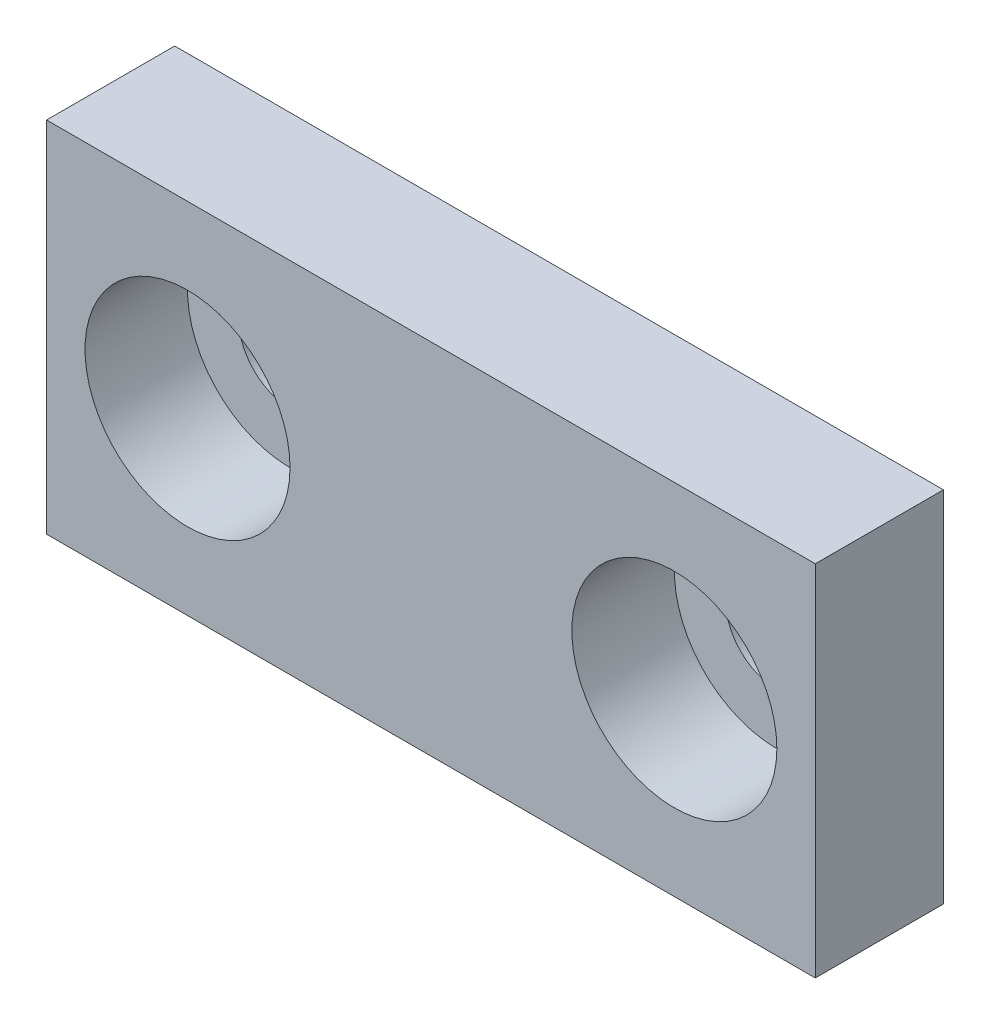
SolidWorks part; units mm, degrees
ref_plane "Front Plane" through (0, 0, 0) normal (0, 0, 1) x (1, 0, 0)
ref_plane "Top Plane" through (0, 0, 0) normal (0, 1, 0) x (1, 0, 0)
ref_plane "Right Plane" through (0, 0, 0) normal (1, 0, 0) x (0, 0, -1)
sketch "Sketch1" plane through (0, 0, 0) normal (0, 0, 1) x (1, 0, 0)
  line L1 (-15, 7) -> (15, 7)
  line L2 (-15, 7) -> (-15, -7)
  line L3 (-15, -7) -> (15, -7)
  line L4 (15, 7) -> (15, -7)
  line L5 (-15, 7) -> (15, -7) construction
  line L6 (-15, -7) -> (15, 7) construction
  point P1 (0, 0)
  dimension "D1" = 30
  dimension "D2" = 14
extrude "Boss-Extrude1" add sketch "Sketch1" along normal blind 5
sketch "Sketch2" plane through (0, 0, 5) normal (0, 0, 1) x (1, 0, 0)
  circle A0 centre (9.5, 0) radius 4
  circle A1 centre (-9.5, 0) radius 4
  point P4 (0, 0)
  dimension "D3" = 8
  dimension "D4" = 8
  dimension "D1" = 19
  dimension "D2" = 9.5
extrude "Cut-Extrude1" cut sketch "Sketch2" against normal blind 4
sketch "Sketch3" plane through (0, 0, 1) normal (0, 0, 1) x (1, 0, 0)
  circle A0 centre (-9.5, 0) radius 2
  circle A1 centre (9.5, 0) radius 2
  dimension "D1" = 4
  dimension "D2" = 4
extrude "Cut-Extrude2" cut sketch "Sketch3" against normal through all
